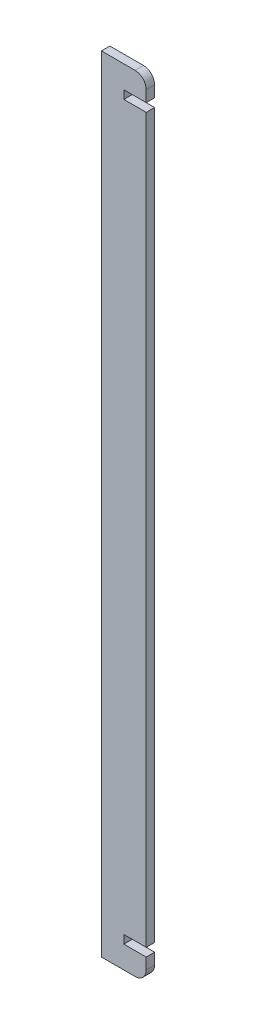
SolidWorks part; units mm, degrees
ref_plane "Front Plane" through (0, 0, 0) normal (0, 0, 1) x (1, 0, 0)
ref_plane "Top Plane" through (0, 0, 0) normal (0, 1, 0) x (1, 0, 0)
ref_plane "Right Plane" through (0, 0, 0) normal (1, 0, 0) x (0, 0, -1)
sketch "Sketch1" plane through (0, 0, 0) normal (0, 0, 1) x (1, 0, 0)
  line L1 (-50.8, 889) -> (50.8, 889)
  line L2 (-50.8, 889) -> (-50.8, -889)
  line L3 (-50.8, -889) -> (50.8, -889)
  line L4 (50.8, 889) -> (50.8, -889)
  line L5 (-50.8, 889) -> (50.8, -889) construction
  line L6 (-50.8, -889) -> (50.8, 889) construction
  point P0 (0, 0)
  dimension "D1" = 101.6
  dimension "D2" = 1778
extrude "Boss-Extrude1" add sketch "Sketch1" along normal blind 19.05 contours L4 L3 L2 L1
sketch "Sketch3" plane through (0, 0, 0) normal (0, 0, -1) x (-1, 0, 0)
  line L0 (-50.8, 889) -> (-50.8, -889) construction
  line L1 (-50.8, 838.2) -> (0, 838.2)
  line L2 (-50.8, 838.2) -> (-50.8, 819.15)
  line L3 (-50.8, 819.15) -> (0, 819.15)
  line L4 (0, 838.2) -> (0, 819.15)
  line L5 (50.8, 889) -> (-50.8, 889) construction
  line L6 (0, 0) -> (50.8, 0) construction
  line L7 (50.8, 889) -> (50.8, -889) construction
  line L8 (0, -838.2) -> (0, -819.15)
  line L9 (-50.8, -819.15) -> (0, -819.15)
  line L10 (-50.8, -838.2) -> (-50.8, -819.15)
  line L11 (-50.8, -838.2) -> (0, -838.2)
  dimension "D1" = 50.8
  dimension "D2" = 19.05
  dimension "D3" = 50.8
extrude "Cut-Extrude1" cut sketch "Sketch3" against normal through all
fillet "Fillet1" radius 25.4 2 edges at (50.8, 889, 9.525) (50.8, -889, 9.525)
